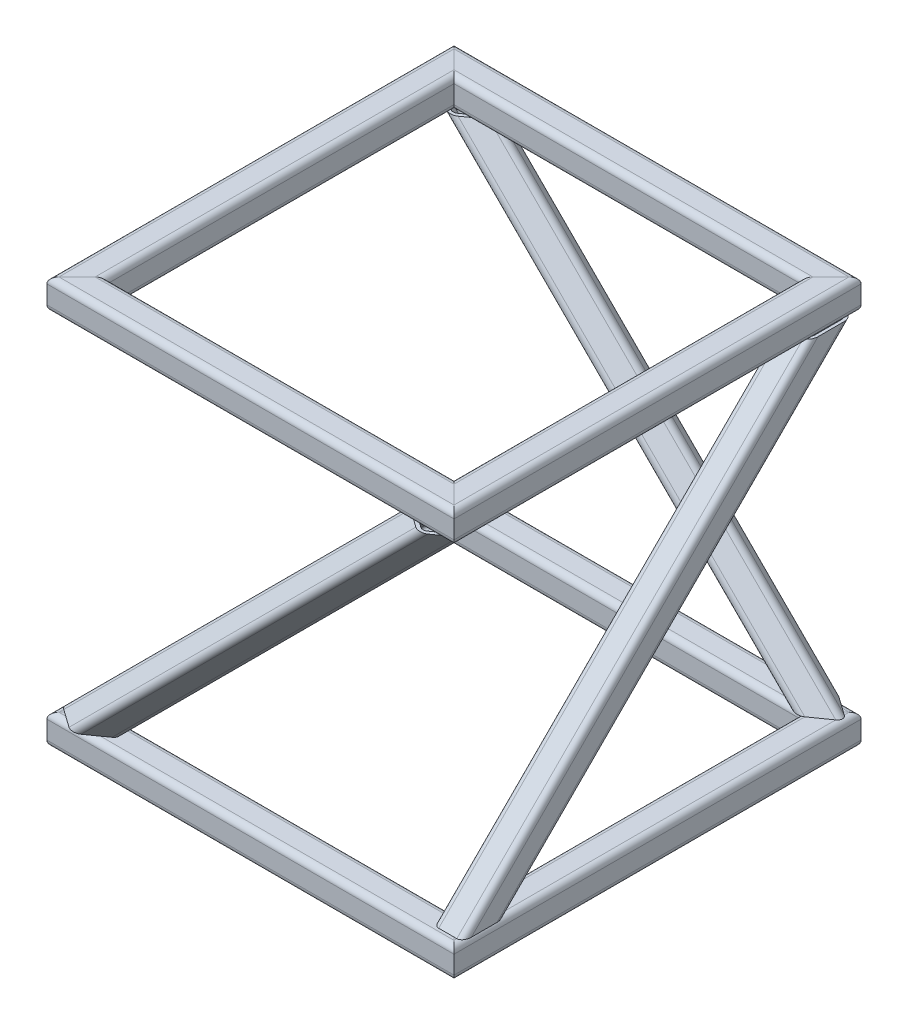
SolidWorks part; units mm, degrees
ref_plane "Front Plane" through (0, 0, 0) normal (0, 0, 1) x (1, 0, 0)
ref_plane "Top Plane" through (0, 0, 0) normal (0, 1, 0) x (1, 0, 0)
ref_plane "Right Plane" through (0, 0, 0) normal (1, 0, 0) x (0, 0, -1)
sketch "Sketch1" plane through (0, 0, 0) normal (0, 1, 0) x (1, 0, 0)
  line L1 (-125, 125) -> (125, 125)
  line L2 (-125, 125) -> (-125, -125)
  line L3 (-125, -125) -> (125, -125)
  line L4 (125, 125) -> (125, -125)
  line L5 (-125, 125) -> (125, -125) construction
  line L6 (-125, -125) -> (125, 125) construction
  point P0 (0, 0)
  dimension "D1" = 250
  dimension "D2" = 250
ref_plane "Plane1" through (0, 250, 0) normal (0, 1, 0) x (1, 0, 0)
sketch "Sketch2" plane through (0, 250, 0) normal (0, 1, 0) x (1, 0, 0)
  line L0 (-125, 125) -> (125, -125) construction
  line L1 (-125, -125) -> (125, 125) construction
  line L2 (-125, 125) -> (125, -125) construction
  line L3 (-125, -125) -> (125, 125) construction
  line L4 (125, 125) -> (-125, 125)
  line L5 (125, -125) -> (125, 125)
  line L6 (-125, -125) -> (125, -125)
  line L7 (-125, 125) -> (-125, -125)
  line L8 (125, 125) -> (-125, 125)
  line L9 (125, -125) -> (125, 125)
  line L10 (-125, -125) -> (125, -125)
  line L11 (-125, 125) -> (-125, -125)
  dimension "D1" = 0
sketch3d "3DSketch1"
  line L0 (-125, 0, 125) -> (125, 250, 125)
  line L1 (125, 0, 125) -> (125, 250, -125)
  line L2 (125, 0, -125) -> (-125, 250, -125)
  line L3 (-125, 0, -125) -> (-125, 250, 125)
other "Square tube 20 X 20 X 2(1)"
ref_plane "Plane2" through (-125, 0, -125) normal (0, 0, 1) x (1, 0, 0)
sketch "Sketch13" plane through (-125, 0, -125) normal (0, 0, 1) x (1, 0, 0)
  line L0 (-6, -8) -> (6, -8)
  line L1 (-8, -6) -> (-8, 6)
  line L2 (6, 8) -> (-6, 8)
  line L3 (8, 6) -> (8, -6)
  line L4 (-6, -10) -> (6, -10)
  line L5 (-10, -6) -> (-10, 6)
  line L6 (6, 10) -> (-6, 10)
  line L7 (10, 6) -> (10, -6)
  arc A0 (10, 6) -> (6, 10) centre (6, 6) ccw
  arc A1 (6, -10) -> (10, -6) centre (6, -6) ccw
  arc A2 (-10, -6) -> (-6, -10) centre (-6, -6) ccw
  arc A3 (-6, 10) -> (-10, 6) centre (-6, 6) ccw
  arc A4 (-6, 8) -> (-8, 6) centre (-6, 6) ccw
  arc A5 (8, 6) -> (6, 8) centre (6, 6) ccw
  arc A6 (6, -8) -> (8, -6) centre (6, -6) ccw
  arc A7 (-8, -6) -> (-6, -8) centre (-6, -6) ccw
  point P0 (-10, 0)
  point P1 (10, 0)
  point P2 (0, 10)
  point P3 (0, -10)
  point P4 (0, 0)
  point P5 (-10, -10)
  point P6 (10, -10)
  point P7 (10, 10)
  point P8 (-10, 10)
  point P33 (0, 0)
  point P35 (0, 0)
  point P36 (0, 0)
  point P37 (0, 0)
  point P38 (0, 0)
  point P39 (0, 0)
  dimension "D1" = 4
  dimension "Thickness" = 2
  dimension "V_leg" = 20
